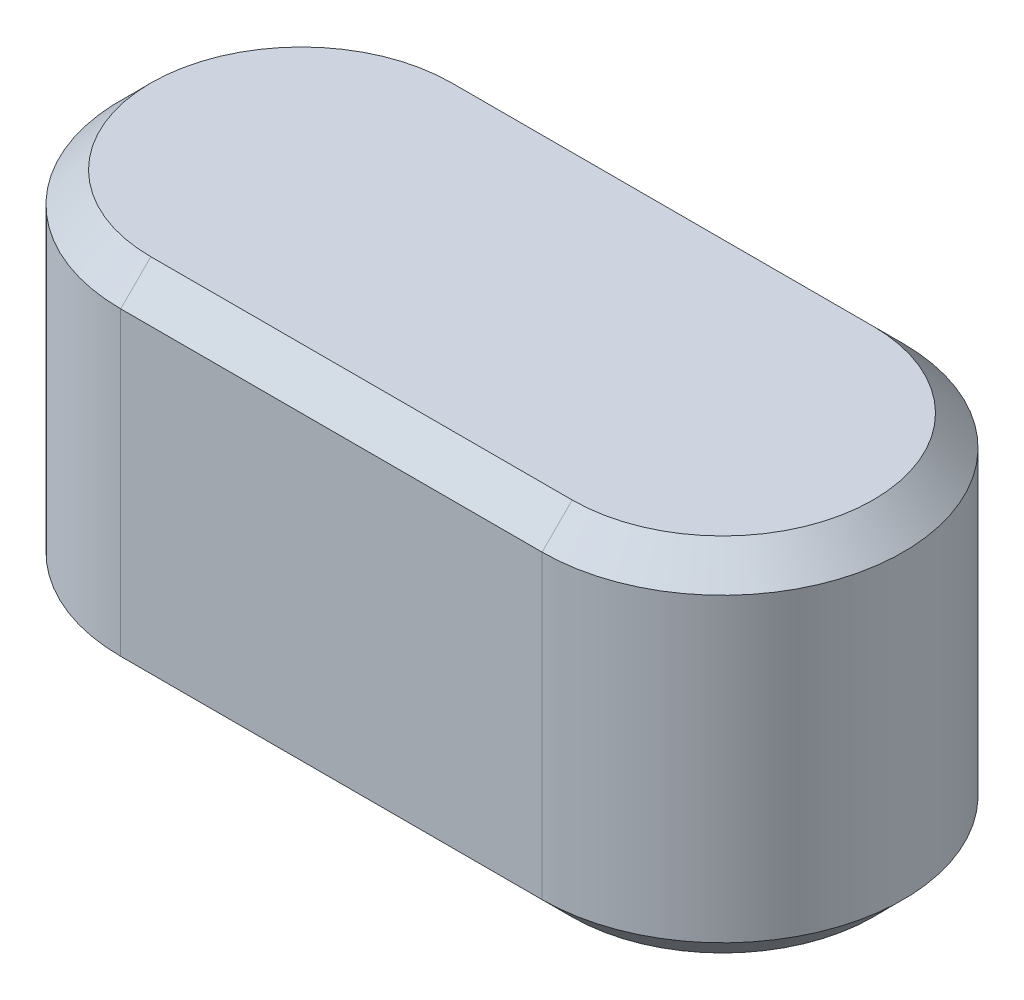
SolidWorks part; units mm, degrees
ref_plane "frontal" through (0, 0, 0) normal (0, 0, 1) x (1, 0, 0)
ref_plane "horizontal" through (0, 0, 0) normal (0, 1, 0) x (1, 0, 0)
ref_plane "profil" through (0, 0, 0) normal (1, 0, 0) x (0, 0, -1)
sketch "Esquisse1" plane through (0, 0, 0) normal (0, 1, 0) x (1, 0, 0)
  line L0 (0, -4) -> (0, 6) construction
  line L1 (-9, 0) -> (9, 0) construction
  line L2 (-3.5, 3) -> (3.5, 3)
  line L3 (-3.5, -3) -> (3.5, -3)
  arc A0 (3.5, 3) -> (3.5, -3) centre (3.5, 0) cw
  arc A1 (-3.5, 3) -> (-3.5, -3) centre (-3.5, 0) ccw
  point P9 (0, 3)
  point P13 (0, -3)
  dimension "D1" = 7
  dimension "D2" = 3
extrude "Base-Extrusion" add sketch "Esquisse1" along normal blind 6
chamfer "Chanfrein1-0.5" distance 0.5 angle 45
